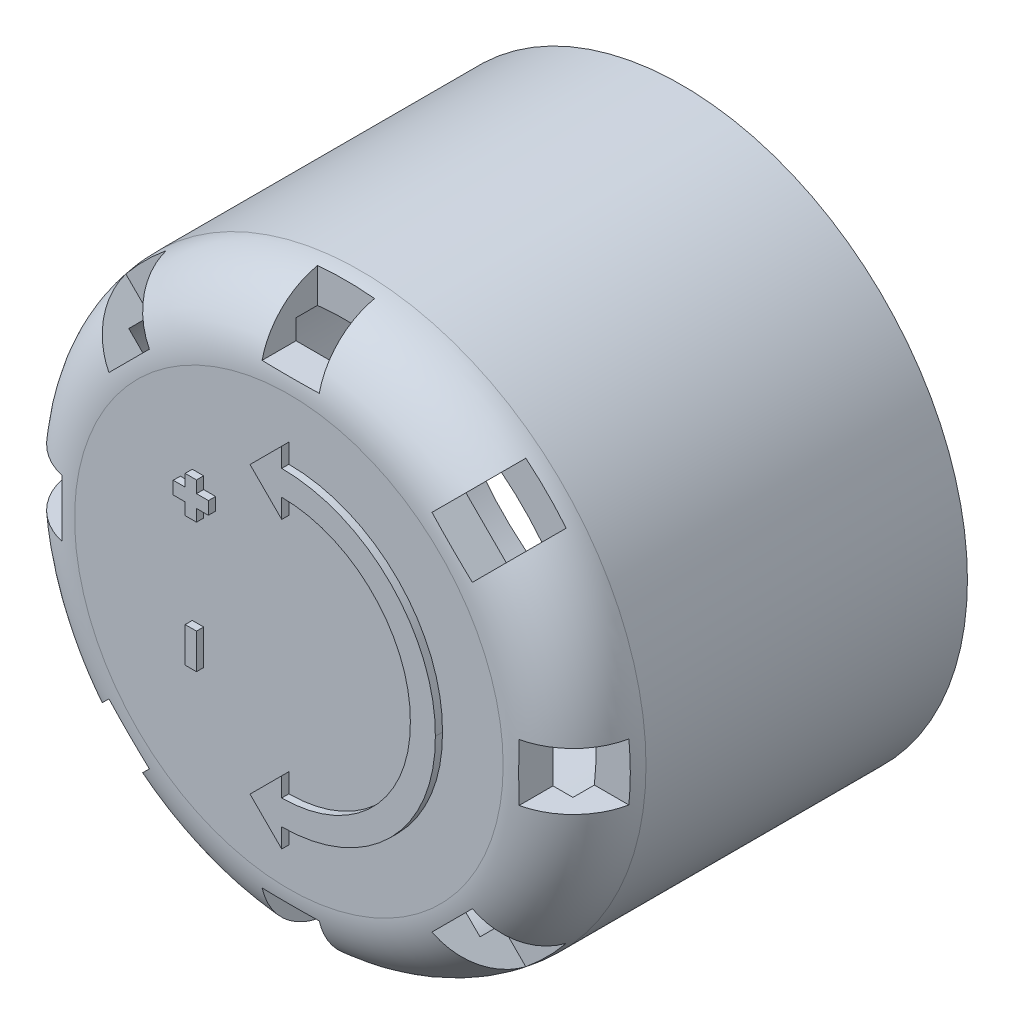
SolidWorks part; units mm, degrees
ref_plane "Plan de face" through (0, 0, 0) normal (0, 0, 1) x (1, 0, 0)
ref_plane "Plan de dessus" through (0, 0, 0) normal (0, 1, 0) x (1, 0, 0)
ref_plane "Plan de droite" through (0, 0, 0) normal (1, 0, 0) x (0, 0, -1)
sketch "Esquisse1" plane through (0, 0, 0) normal (0, 0, 1) x (1, 0, 0)
  circle A0 centre (0, 0) radius 8
  dimension "D1" = 16
extrude "Extrusion1" add sketch "Esquisse1" along normal blind 11
shell "Coque1" thickness 1
fillet "Congé1" radius 2 1 edges at (8, 0, 11)
sketch "Esquisse2" plane through (0, 0, 11) normal (0, 0, 1) x (1, 0, 0)
  line L0 (0, 0) -> (0, 16.0836) construction
  line L1 (5.0912, 6.2225) -> (6.2225, 5.0912)
  line L2 (-0.8, 8) -> (0.8, 8)
  line L3 (-0.8, 8) -> (-0.8, 6.3958)
  line L4 (-0.8, 6.3958) -> (0.8, 6.3958)
  line L5 (0.8, 8) -> (0.8, 6.3958)
  line L6 (5.0912, 6.2225) -> (3.9568, 5.0882)
  line L7 (3.9568, 5.0882) -> (5.0882, 3.9568)
  line L8 (6.2225, 5.0912) -> (5.0882, 3.9568)
  line L9 (8, 0.8) -> (8, -0.8)
  line L10 (8, 0.8) -> (6.3958, 0.8)
  line L11 (6.3958, 0.8) -> (6.3958, -0.8)
  line L12 (8, -0.8) -> (6.3958, -0.8)
  line L13 (6.2225, -5.0912) -> (5.0912, -6.2225)
  line L14 (6.2225, -5.0912) -> (5.0882, -3.9568)
  line L15 (5.0882, -3.9568) -> (3.9568, -5.0882)
  line L16 (5.0912, -6.2225) -> (3.9568, -5.0882)
  line L17 (0.8, -8) -> (-0.8, -8)
  line L18 (0.8, -8) -> (0.8, -6.3958)
  line L19 (0.8, -6.3958) -> (-0.8, -6.3958)
  line L20 (-0.8, -8) -> (-0.8, -6.3958)
  line L21 (-5.0912, -6.2225) -> (-6.2225, -5.0912)
  line L22 (-5.0912, -6.2225) -> (-3.9568, -5.0882)
  line L23 (-3.9568, -5.0882) -> (-5.0882, -3.9568)
  line L24 (-6.2225, -5.0912) -> (-5.0882, -3.9568)
  line L25 (-8, -0.8) -> (-8, 0.8)
  line L26 (-8, -0.8) -> (-6.3958, -0.8)
  line L27 (-6.3958, -0.8) -> (-6.3958, 0.8)
  line L28 (-8, 0.8) -> (-6.3958, 0.8)
  line L29 (-6.2225, 5.0912) -> (-5.0912, 6.2225)
  line L30 (-6.2225, 5.0912) -> (-5.0882, 3.9568)
  line L31 (-5.0882, 3.9568) -> (-3.9568, 5.0882)
  line L32 (-5.0912, 6.2225) -> (-3.9568, 5.0882)
  circle A0 centre (0, 0) radius 8 construction
  dimension "D1" = 0.8
  dimension "D2" = 0.8
  dimension "D3" = 1.6042
extrude "Enlèv. mat.-Extru.1" cut sketch "Esquisse2" against normal blind 1.6
sketch "Esquisse3" plane through (0, 0, 11) normal (0, 0, 1) x (1, 0, 0)
  line L0 (0, 4.3014) -> (0, 4.8394)
  line L1 (0, 4.8394) -> (-0.8881, 3.9514)
  line L2 (-0.8881, 3.9514) -> (0, 3.0633)
  line L3 (0, 3.0633) -> (0, 3.6014)
  line L4 (3.6011, -0.0448) -> (4.6842, -0.0448) construction
  line L5 (0, -3.1529) -> (0, -3.6909)
  line L6 (-0.8881, -4.0409) -> (0, -3.1529)
  line L7 (0, -4.929) -> (-0.8881, -4.0409)
  line L8 (0, -4.3909) -> (0, -4.929)
  line L9 (-2.3868, 2.4948) -> (-2.0532, 2.4948)
  line L10 (-2.3868, 2.8284) -> (-2.7043, 2.8284)
  line L11 (-2.3868, 2.8284) -> (-2.3868, 2.4948)
  line L12 (-2.3868, 1.8033) -> (-2.7043, 1.8033)
  line L13 (-2.7043, 2.8284) -> (-2.7043, 2.4948)
  line L14 (-3.0379, 2.4948) -> (-2.7043, 2.4948)
  line L15 (-3.0379, 2.4948) -> (-3.0379, 2.1369)
  line L16 (-3.0379, 2.1369) -> (-2.7043, 2.1369)
  line L17 (-2.0532, 2.4948) -> (-2.0532, 2.1369)
  line L18 (-2.7043, -0.8373) -> (-2.3868, -0.8373)
  line L19 (-2.7043, -0.8373) -> (-2.7043, -1.8223)
  line L20 (-2.7043, -1.8223) -> (-2.3868, -1.8223)
  line L21 (-2.3868, -0.8373) -> (-2.3868, -1.8223)
  line L22 (-2.7043, 2.1369) -> (-2.7043, 1.8033)
  line L23 (-2.3868, 2.1369) -> (-2.0532, 2.1369)
  line L24 (-2.3868, 2.1369) -> (-2.3868, 1.8033)
  arc A0 (0, 4.3014) -> (4.3011, -0.0478) centre (0, 0) cw
  arc A1 (0, 3.6014) -> (3.6011, -0.0448) centre (0, 0) cw
  arc A2 (0, -3.6909) -> (3.6011, -0.0448) centre (0, -0.0896) ccw
  arc A3 (0, -4.3909) -> (4.3011, -0.0417) centre (0, -0.0896) ccw
  dimension "D1" = 0.7
extrude "Extrusion2" add sketch "Esquisse3" along normal blind 0.2
